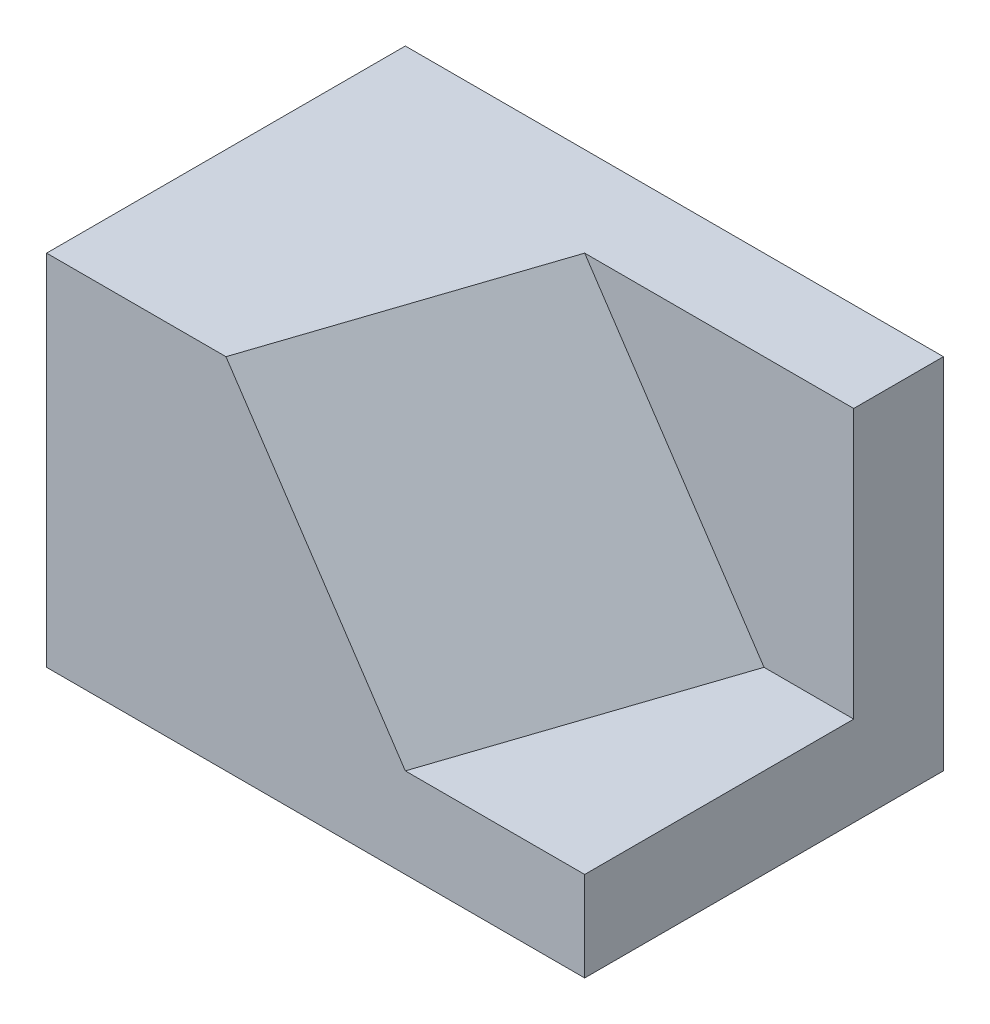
SolidWorks part; units mm, degrees
ref_plane "Front Plane" through (0, 0, 0) normal (0, 0, 1) x (1, 0, 0)
ref_plane "Top Plane" through (0, 0, 0) normal (0, 1, 0) x (1, 0, 0)
ref_plane "Right Plane" through (0, 0, 0) normal (1, 0, 0) x (0, 0, -1)
sketch "Sketch1" plane through (0, 0, 0) normal (0, 1, 0) x (1, 0, 0)
  line L1 (0, 0) -> (60, 0)
  line L2 (0, 0) -> (0, 40)
  line L3 (0, 40) -> (60, 40)
  line L4 (60, 0) -> (60, 40)
  dimension "D1" = 60
  dimension "D2" = 40
extrude "Extrude1" add sketch "Sketch1" along normal blind 30 and the other way blind 10
sketch "Sketch2" plane through (0, 30, 0) normal (0, 1, 0) x (1, 0, 0)
  line L0 (60, 30) -> (30, 30)
  line L1 (60, 0) -> (60, 40) construction
  line L2 (30, 30) -> (20, 0)
  line L3 (0, 0) -> (60, 0) construction
  line L4 (20, 0) -> (60, 0)
  line L5 (60, 0) -> (60, 30)
  dimension "D1" = 40
  dimension "D2" = 30
  dimension "D3" = 30
sketch "Sketch3" plane through (0, 0, 0) normal (0, 1, 0) x (1, 0, 0)
  line L0 (60, 0) -> (40, 0)
  line L1 (40, 0) -> (50, 30)
  line L2 (50, 30) -> (60, 30)
  line L3 (60, 30) -> (60, 0)
  line L4 (60, 30) -> (30, 30) construction
  line L5 (30, 30) -> (20, 0) construction
  dimension "D1" = 10
loft "Cut-Loft1" cut profiles "Sketch2", "Sketch3"
